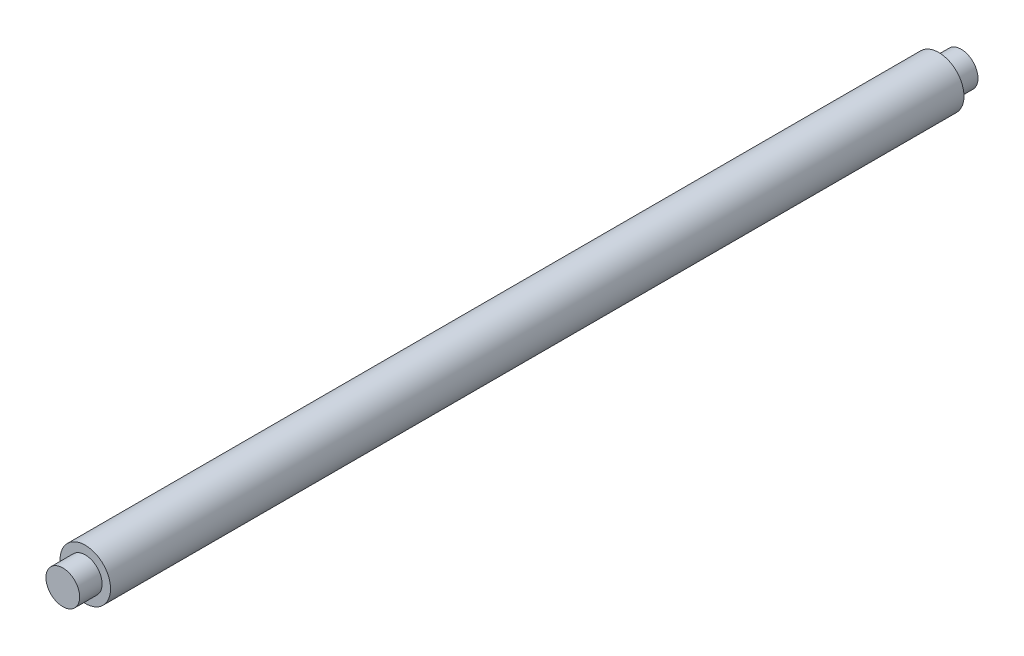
SolidWorks part; units mm, degrees
ref_plane "Face" through (0, 0, 0) normal (0, 0, 1) x (1, 0, 0)
ref_plane "Dessus" through (0, 0, 0) normal (0, 1, 0) x (1, 0, 0)
ref_plane "Droite" through (0, 0, 0) normal (1, 0, 0) x (0, 0, -1)
sketch "Esquisse1" plane through (0, 0, 0) normal (0, 0, 1) x (1, 0, 0)
  circle A0 centre (0, 0) radius 2.25
  dimension "D1" = 4.5
extrude "Extrusion1" add sketch "Esquisse1" along normal blind 38
sketch "Esquisse2" plane through (0, 0, 38) normal (0, 0, 1) x (1, 0, 0)
  circle A0 centre (0, 0) radius 1.5
  dimension "D1" = 3
extrude "Extrusion2" add sketch "Esquisse2" along normal blind 2
mirror "Symétrie1" about plane through (0, 0, 0) normal (0, 0, 1)
